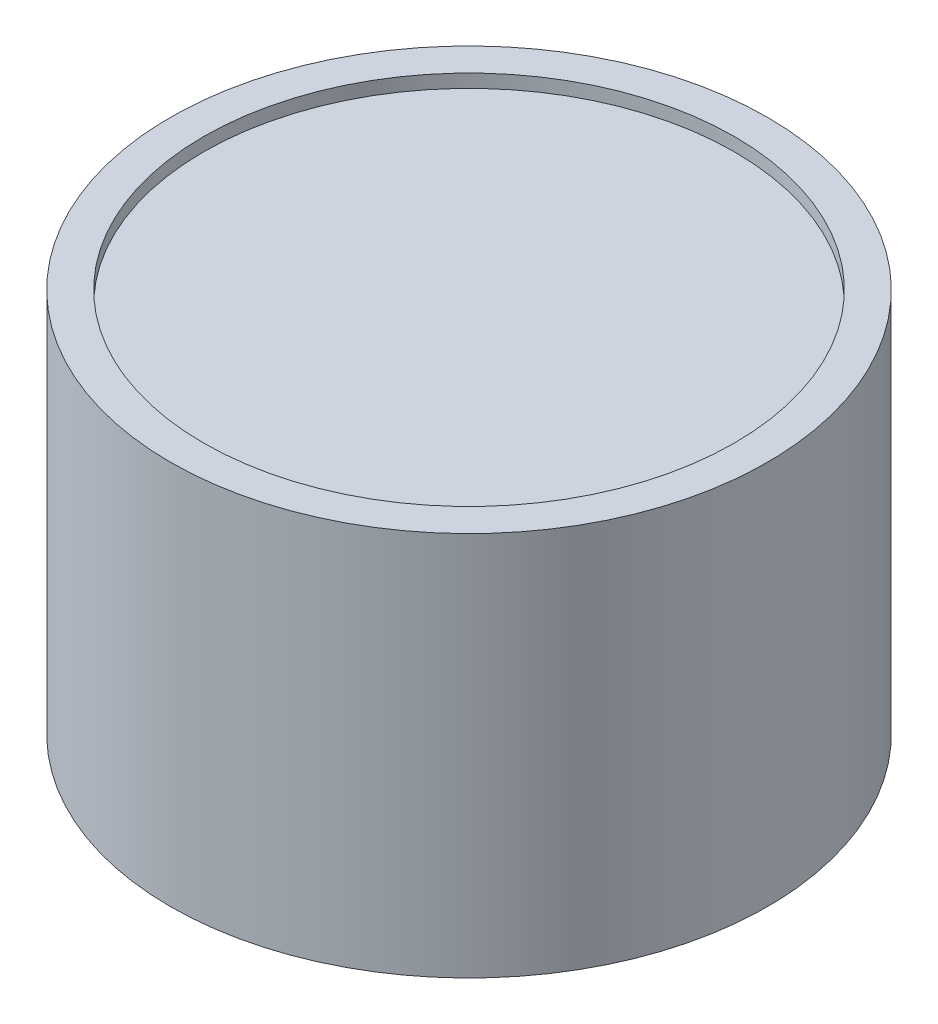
SolidWorks part; units mm, degrees
ref_plane "Alzado" through (0, 0, 0) normal (0, 0, 1) x (1, 0, 0)
ref_plane "Planta" through (0, 0, 0) normal (0, 1, 0) x (1, 0, 0)
ref_plane "Vista lateral" through (0, 0, 0) normal (1, 0, 0) x (0, 0, -1)
sketch "Croquis1" plane through (0, 0, 0) normal (0, 1, 0) x (1, 0, 0)
  circle A0 centre (0, 0) radius 45
  dimension "D1" = 90
extrude "Saliente-Extruir1" add sketch "Croquis1" along normal blind 58
sketch "Croquis2" plane through (0, 58, 0) normal (0, 1, 0) x (1, 0, 0)
  circle A2 centre (0, 0) radius 40
  circle A3 centre (0, 0) radius 40
  dimension "D1" = 5
extrude "Cortar-Extruir1" cut sketch "Croquis2" against normal blind 2
